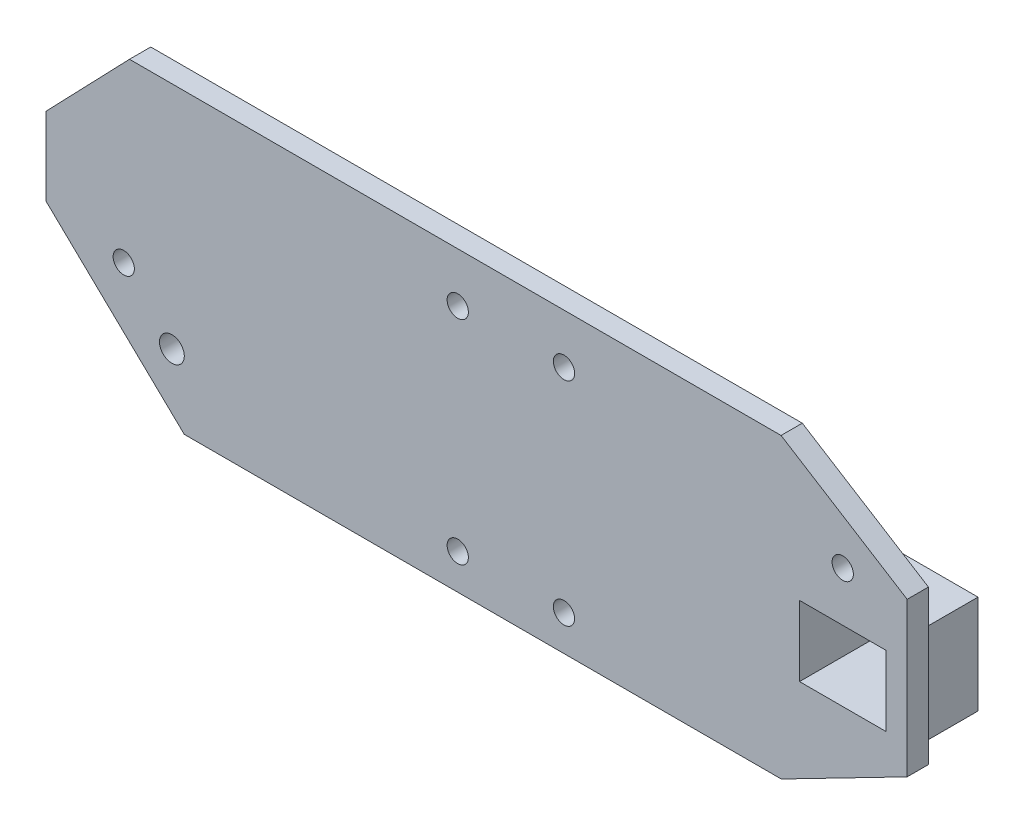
SolidWorks part; units mm, degrees
ref_plane "Front Plane" through (0, 0, 0) normal (0, 0, 1) x (1, 0, 0)
ref_plane "Top Plane" through (0, 0, 0) normal (0, 1, 0) x (1, 0, 0)
ref_plane "Right Plane" through (0, 0, 0) normal (1, 0, 0) x (0, 0, -1)
sketch "Sketch1" plane through (0, 0, 0) normal (0, 0, 1) x (1, 0, 0)
  line L0 (-125.1866, 38.8744) -> (-33.1866, 38.8744)
  line L1 (-117.4534, -3.1256) -> (-33.1634, -3.1256)
  line L2 (-33.1866, 38.8744) -> (-15.3812, 27.7402)
  line L3 (-15.3812, 27.7402) -> (-15.3812, 6.0283)
  line L4 (-15.3812, 6.0283) -> (-33.1634, -3.1256)
  line L5 (-117.4534, -3.1256) -> (-136.9752, 15.6258)
  line L6 (-136.9752, 15.6258) -> (-136.9752, 26.6258)
  line L7 (-136.9752, 26.6258) -> (-125.1866, 38.8744)
  dimension "D1" = 92
  dimension "D2" = 84.29
  dimension "D3" = 42
  dimension "D4" = 20
  dimension "D5" = 21
  dimension "D6" = 21.7119
  dimension "D7" = 27.0688
  dimension "D8" = 11
  dimension "D9" = 17
extrude "Boss-Extrude1" add sketch "Sketch1" along normal blind 3
sketch "Sketch2" plane through (0, 0, 3) normal (0, 0, 1) x (1, 0, 0)
  line L0 (-24.4812, 20.0093) -> (-24.4812, 27.0093) construction
  line L1 (-15.3812, 6.0283) -> (-15.3812, 27.7402) construction
  line L2 (-18.3812, 10.0793) -> (-18.3812, 20.0093)
  line L3 (-18.3812, 20.0093) -> (-30.5812, 20.0093)
  line L4 (-30.5812, 20.0093) -> (-30.5812, 10.0793)
  line L5 (-30.5812, 10.0793) -> (-18.3812, 10.0793)
  line L8 (-24.4812, 20.0093) -> (-24.4812, 20.1093) construction
  line L12 (-15.3812, 16.8843) -> (-15.3812, 15.0443) construction
  line L13 (-15.3812, 15.0443) -> (-18.3812, 15.0443) construction
  circle A1 centre (-24.4812, 27.0093) radius 1.5
  point P7 (-18.3812, 15.0443)
  dimension "D9" = 3
  dimension "D2" = 9.93
  dimension "D3" = 12.2
  dimension "D6" = 0.1
  dimension "D7" = 7
  dimension "D10" = 1.84
  dimension "D11" = 3
extrude "Cut-Extrude2" cut sketch "Sketch2" against normal blind 5
sketch "Sketch4" plane through (0, 0, 0) normal (0, 0, -1) x (-1, 0, 0)
  line L0 (79.1866, 38.8744) -> (79.1866, 33.8744) construction
  line L1 (33.1866, 38.8744) -> (125.1866, 38.8744) construction
  line L2 (63.8366, 31.8744) -> (63.8366, 38.8744) construction
  line L3 (63.8366, 31.8744) -> (63.8366, 1.8744) construction
  line L4 (78.8366, 31.8744) -> (78.8366, 1.8744) construction
  line L5 (78.8366, 31.8744) -> (78.8366, 38.8744) construction
  circle A0 centre (63.8366, 31.8744) radius 1.5
  circle A1 centre (78.8366, 31.8744) radius 1.5
  circle A2 centre (63.8366, 1.8744) radius 1.5
  circle A3 centre (78.8366, 1.8744) radius 1.5
  point P7 (79.1866, 33.8744)
  dimension "D3" = 3
  dimension "D4" = 3
  dimension "D7" = 3
  dimension "D8" = 3
  dimension "D1" = 5
  dimension "D2" = 15
  dimension "D5" = 30
  dimension "D6" = 30
  dimension "D9" = 7
  dimension "D10" = 7
extrude "Cut-Extrude4" cut sketch "Sketch4" against normal blind 3
sketch "Sketch5" plane through (0, 0, 0) normal (0, 0, -1) x (-1, 0, 0)
  line L0 (18.3812, 20.0093) -> (30.5812, 20.0093)
  line L1 (30.5812, 20.0093) -> (30.5812, 10.0793)
  line L2 (30.5812, 10.0793) -> (18.3812, 10.0793)
  line L3 (18.3812, 10.0793) -> (18.3812, 20.0093)
  line L4 (16.3812, 8.0793) -> (16.3812, 22.0093)
  line L5 (16.3812, 22.0093) -> (32.5812, 22.0093)
  line L6 (32.5812, 22.0093) -> (32.5812, 8.0793)
  line L7 (32.5812, 8.0793) -> (16.3812, 8.0793)
  dimension "D1" = 2
extrude "Boss-Extrude2" add sketch "Sketch5" along normal blind 8
sketch "Sketch6" plane through (0, 0, 0) normal (0, 0, -1) x (-1, 0, 0)
  line L0 (117.4534, -3.1256) -> (117.4534, 6.4444) construction
  line L1 (117.4534, 6.4444) -> (119.1991, 6.4444) construction
  line L2 (136.9752, 15.6258) -> (125.9989, 15.6258) construction
  line L3 (125.9989, 15.6258) -> (125.9989, 13.5903) construction
  circle A0 centre (119.1991, 6.4444) radius 1.7526
  circle A1 centre (125.9989, 13.5903) radius 1.5
  dimension "D3" = 3.5052
  dimension "D6" = 3
  dimension "D1" = 9.57
  dimension "D2" = 1.7457
  dimension "D4" = 10.9763
  dimension "D5" = 2.0355
extrude "Cut-Extrude5" cut sketch "Sketch6" against normal blind 5
